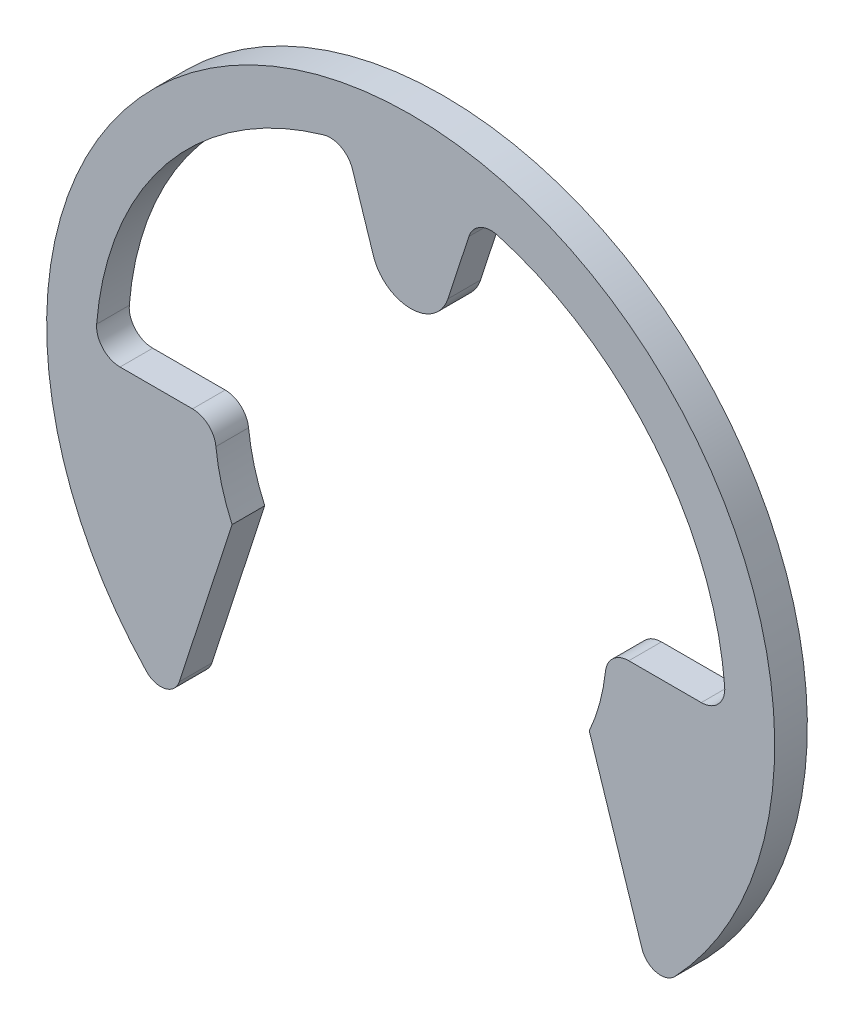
SolidWorks part; units mm, degrees
ref_plane "Front Plane" through (0, 0, 0) normal (0, 0, 1) x (1, 0, 0)
ref_plane "Top Plane" through (0, 0, 0) normal (0, 1, 0) x (1, 0, 0)
ref_plane "Right Plane" through (0, 0, 0) normal (1, 0, 0) x (0, 0, -1)
sketch "BodySke" plane through (0, 0, 0) normal (0, 0, 1) x (1, 0, 0)
  line L0 (-34.7902, 0) -> (37.4871, 0) construction
  line L1 (0, -29.1266) -> (0, 42.3415) construction
  line L2 (10.94, -4.9312) -> (14.1741, -14.8846)
  line L3 (-10.94, -4.9312) -> (-14.1741, -14.8846)
  line L4 (12, 0) -> (19.3, 0)
  line L5 (-12, 0) -> (-19.3, 0)
  line L6 (-1.7042, 11.8784) -> (-3.9808, 18.885) construction
  line L7 (1.7042, 11.8784) -> (3.9808, 18.885) construction
  line L8 (-2.2825, 13.6584) -> (-3.9808, 18.885)
  line L9 (2.2825, 13.6584) -> (3.9808, 18.885)
  arc A0 (16.1864, -15.3392) -> (-16.1864, -15.3392) centre (0, 0) ccw
  arc A1 (-12, 0) -> (-10.94, -4.9312) centre (0, 0) ccw
  arc A2 (-3.9808, 18.885) -> (-19.3, 0) centre (0, 0) ccw
  arc A3 (1.7042, 11.8784) -> (-1.7042, 11.8784) centre (0, 0) ccw construction
  circle A4 centre (0, 0) radius 19.3 construction
  circle A5 centre (0, 0) radius 22.3 construction
  arc A6 (10.94, -4.9312) -> (12, 0) centre (0, 0) ccw
  arc A7 (19.3, 0) -> (3.9808, 18.885) centre (0, 0) ccw
  arc A8 (-14.1741, -14.8846) -> (-16.1864, -15.3392) centre (-15.3153, -14.5138) cw
  arc A9 (16.1864, -15.3392) -> (14.1741, -14.8846) centre (15.3153, -14.5138) cw
  arc A10 (-2.2825, 13.6584) -> (2.2825, 13.6584) centre (0, 14.4) ccw
  point P23 (-14.7671, -16.7099)
  point P26 (14.7671, -16.7099)
  point P29 (-19.3, 0)
  point P32 (19.3, 0)
  point P35 (3.9808, 18.885)
  point P38 (-3.9808, 18.885)
  dimension "D1" = 4.8
  dimension "Outside_Diameter" = 44.6
  dimension "Inside_Diameter" = 24
  dimension "D8" = 1.2
  dimension "Width" = 21.88
  dimension "Groove_angle" = 18
  dimension "Angle" = 36
  dimension "Groove_Width" = 3
extrude "BaseBody" add sketch "BodySke" along normal blind 2
fillet "Fillet1" radius 1.44 6 edges at (19.3, 0, 1) (-19.3, 0, 1) (3.9808, 18.885, 1) (-3.9808, 18.885, 1) (12, 0, 1) (-12, 0, 1)
equation "\"D8@BodySke\" = \"Inside_Diameter@BodySke\" * 0.05"
equation "\"Fillet_radius@Fillet1\" = \"Inside_Diameter@BodySke\" * 0.06"
equation "\"D1@BodySke\" = \"Inside_Diameter@BodySke\" / 5"
